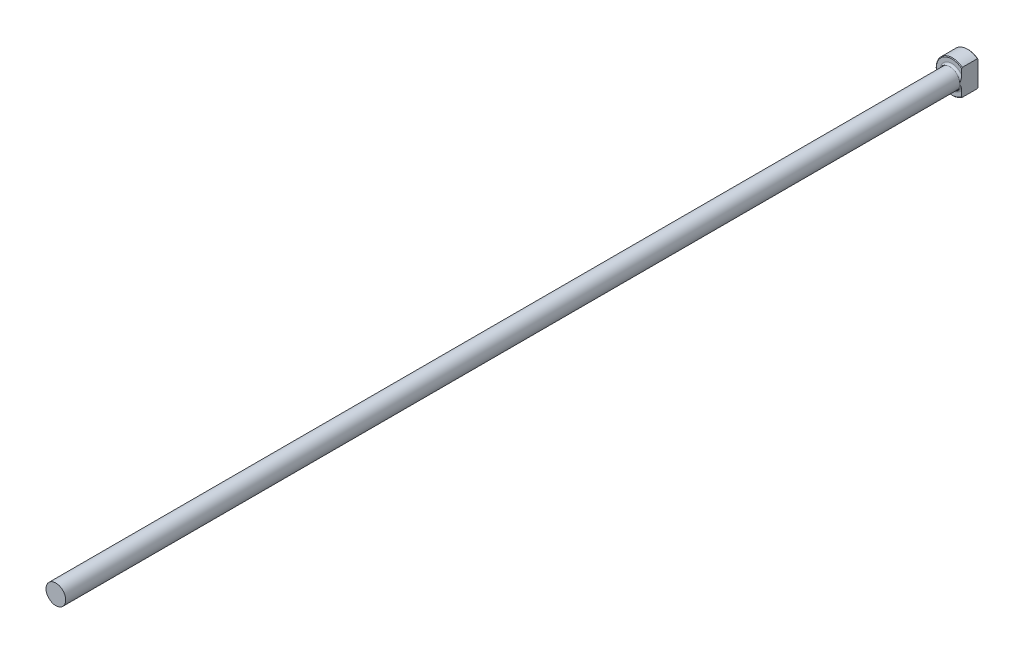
SolidWorks part; units mm, degrees
ref_plane "Front Plane" through (0, 0, 0) normal (0, 0, 1) x (1, 0, 0)
ref_plane "Top Plane" through (0, 0, 0) normal (0, 1, 0) x (1, 0, 0)
ref_plane "Right Plane" through (0, 0, 0) normal (1, 0, 0) x (0, 0, -1)
sketch "Sketch1" plane through (0, 0, 0) normal (1, 0, 0) x (0, 0, -1)
  line L0 (0, 0) -> (0, 6.35)
  line L1 (0, 6.35) -> (-6.35, 6.35)
  line L2 (-6.35, 6.35) -> (-6.35, 4.5949)
  line L3 (-7.112, 3.8329) -> (-355.6, 3.8329)
  line L4 (-355.6, 3.8329) -> (-355.6, 0)
  line L5 (-355.6, 0) -> (0, 0)
  line L6 (25.4347, 0) -> (-130.6739, 0) construction
  arc A0 (-6.35, 4.5949) -> (-7.112, 3.8329) centre (-7.112, 4.5949) cw
  dimension "D4" = 0.762
  dimension "D1" = 7.6657
  dimension "D2" = 12.7
  dimension "D3" = 6.35
  dimension "D5" = 355.6
revolve "Revolve1" add sketch "Sketch1" angle 360 about L6
chamfer "Chamfer1" distance 0.254 angle 45 2 edges at (-6.35, 0, 0) (-6.35, 0, 6.35)
sketch "Sketch2" plane through (0, 0, 0) normal (0, 0, -1) x (-1, 0, 0)
  line L1 (-3.8329, 5.0628) -> (-3.8329, -5.0628)
  circle A1 centre (0, 0) radius 6.35 construction
  circle A2 centre (0, 0) radius 3.8329 construction
  arc A5 (-3.8329, -5.0628) -> (-3.8329, 5.0628) centre (0, 0) cw
extrude "Cut-Extrude1" cut sketch "Sketch2" against normal up to next
